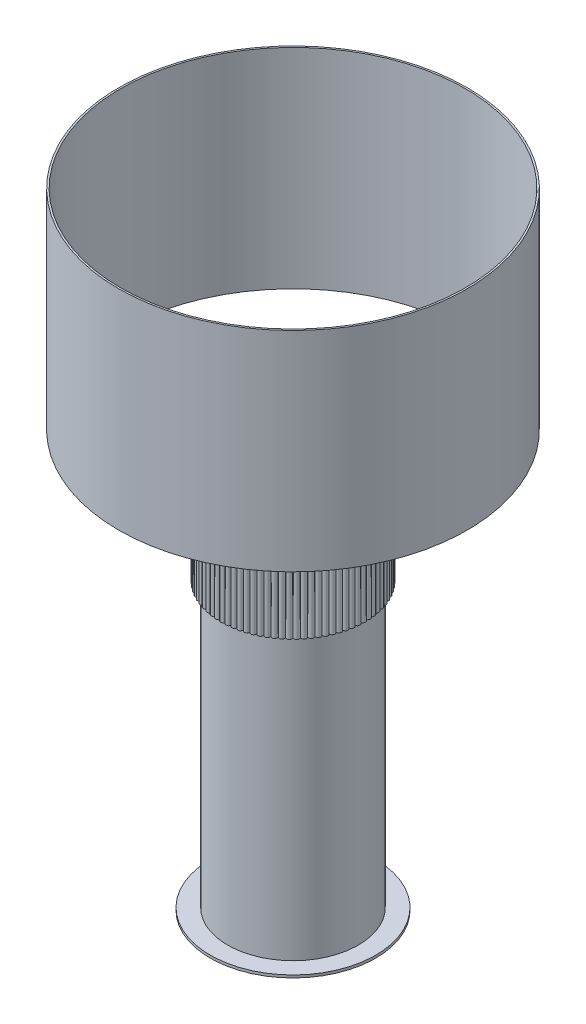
SolidWorks part; units mm, degrees
ref_plane "Alzado" through (0, 0, 0) normal (0, 0, 1) x (1, 0, 0)
ref_plane "Planta" through (0, 0, 0) normal (0, 1, 0) x (1, 0, 0)
ref_plane "Vista lateral" through (0, 0, 0) normal (1, 0, 0) x (0, 0, -1)
sketch "Croquis1" plane through (0, 0, 0) normal (0, 1, 0) x (1, 0, 0)
  arc A224 (2.9977, 80.1164) -> (-2.9977, 80.1164) centre (0, 80) ccw
  arc A225 (8.9765, 79.6683) -> (2.9977, 80.1164) centre (5.9784, 79.7763) ccw
  arc A226 (14.905, 78.7747) -> (8.9765, 79.6683) centre (11.9234, 79.1065) ccw
  arc A227 (20.7501, 77.4406) -> (14.905, 78.7747) centre (17.8017, 77.9942) ccw
  arc A228 (26.4793, 75.6734) -> (20.7501, 77.4406) centre (23.5804, 76.4458) ccw
  arc A229 (32.0603, 73.483) -> (26.4793, 75.6734) centre (29.2273, 74.4699) ccw
  arc A230 (37.4621, 70.8817) -> (32.0603, 73.483) centre (34.7107, 72.0775) ccw
  arc A231 (42.6543, 67.8839) -> (37.4621, 70.8817) centre (40, 69.282) ccw
  arc A232 (47.608, 64.5066) -> (42.6543, 67.8839) centre (45.0656, 66.0991) ccw
  arc A233 (52.2955, 60.7684) -> (47.608, 64.5066) centre (49.8792, 62.5465) ccw
  arc A234 (56.6905, 56.6905) -> (52.2955, 60.7684) centre (54.4138, 58.6441) ccw
  arc A235 (60.7684, 52.2955) -> (56.6905, 56.6905) centre (58.6441, 54.4138) ccw
  arc A236 (64.5066, 47.608) -> (60.7684, 52.2955) centre (62.5465, 49.8792) ccw
  arc A237 (67.8839, 42.6543) -> (64.5066, 47.608) centre (66.0991, 45.0656) ccw
  arc A238 (70.8817, 37.4621) -> (67.8839, 42.6543) centre (69.282, 40) ccw
  arc A239 (73.483, 32.0603) -> (70.8817, 37.4621) centre (72.0775, 34.7107) ccw
  arc A240 (75.6734, 26.4793) -> (73.483, 32.0603) centre (74.4699, 29.2273) ccw
  arc A241 (77.4406, 20.7501) -> (75.6734, 26.4793) centre (76.4458, 23.5804) ccw
  arc A242 (78.7747, 14.905) -> (77.4406, 20.7501) centre (77.9942, 17.8017) ccw
  arc A243 (79.6683, 8.9765) -> (78.7747, 14.905) centre (79.1065, 11.9234) ccw
  arc A244 (80.1164, 2.9977) -> (79.6683, 8.9765) centre (79.7763, 5.9784) ccw
  arc A245 (80.1164, -2.9977) -> (80.1164, 2.9977) centre (80, 0) ccw
  arc A246 (79.6683, -8.9765) -> (80.1164, -2.9977) centre (79.7763, -5.9784) ccw
  arc A247 (78.7747, -14.905) -> (79.6683, -8.9765) centre (79.1065, -11.9234) ccw
  arc A248 (77.4406, -20.7501) -> (78.7747, -14.905) centre (77.9942, -17.8017) ccw
  arc A249 (75.6734, -26.4793) -> (77.4406, -20.7501) centre (76.4458, -23.5804) ccw
  arc A250 (73.483, -32.0603) -> (75.6734, -26.4793) centre (74.4699, -29.2273) ccw
  arc A251 (70.8817, -37.4621) -> (73.483, -32.0603) centre (72.0775, -34.7107) ccw
  arc A252 (67.8839, -42.6543) -> (70.8817, -37.4621) centre (69.282, -40) ccw
  arc A253 (64.5066, -47.608) -> (67.8839, -42.6543) centre (66.0991, -45.0656) ccw
  arc A254 (60.7684, -52.2955) -> (64.5066, -47.608) centre (62.5465, -49.8792) ccw
  arc A255 (56.6905, -56.6905) -> (60.7684, -52.2955) centre (58.6441, -54.4138) ccw
  arc A256 (52.2955, -60.7684) -> (56.6905, -56.6905) centre (54.4138, -58.6441) ccw
  arc A257 (47.608, -64.5066) -> (52.2955, -60.7684) centre (49.8792, -62.5465) ccw
  arc A258 (42.6543, -67.8839) -> (47.608, -64.5066) centre (45.0656, -66.0991) ccw
  arc A259 (37.4621, -70.8817) -> (42.6543, -67.8839) centre (40, -69.282) ccw
  arc A260 (32.0603, -73.483) -> (37.4621, -70.8817) centre (34.7107, -72.0775) ccw
  arc A261 (26.4793, -75.6734) -> (32.0603, -73.483) centre (29.2273, -74.4699) ccw
  arc A262 (20.7501, -77.4406) -> (26.4793, -75.6734) centre (23.5804, -76.4458) ccw
  arc A263 (14.905, -78.7747) -> (20.7501, -77.4406) centre (17.8017, -77.9942) ccw
  arc A264 (8.9765, -79.6683) -> (14.905, -78.7747) centre (11.9234, -79.1065) ccw
  arc A265 (2.9977, -80.1164) -> (8.9765, -79.6683) centre (5.9784, -79.7763) ccw
  arc A266 (-2.9977, -80.1164) -> (2.9977, -80.1164) centre (0, -80) ccw
  arc A267 (-8.9765, -79.6683) -> (-2.9977, -80.1164) centre (-5.9784, -79.7763) ccw
  arc A268 (-14.905, -78.7747) -> (-8.9765, -79.6683) centre (-11.9234, -79.1065) ccw
  arc A269 (-20.7501, -77.4406) -> (-14.905, -78.7747) centre (-17.8017, -77.9942) ccw
  arc A270 (-26.4793, -75.6734) -> (-20.7501, -77.4406) centre (-23.5804, -76.4458) ccw
  arc A271 (-32.0603, -73.483) -> (-26.4793, -75.6734) centre (-29.2273, -74.4699) ccw
  arc A272 (-37.4621, -70.8817) -> (-32.0603, -73.483) centre (-34.7107, -72.0775) ccw
  arc A273 (-42.6543, -67.8839) -> (-37.4621, -70.8817) centre (-40, -69.282) ccw
  arc A274 (-47.608, -64.5066) -> (-42.6543, -67.8839) centre (-45.0656, -66.0991) ccw
  arc A275 (-52.2955, -60.7684) -> (-47.608, -64.5066) centre (-49.8792, -62.5465) ccw
  arc A276 (-56.6905, -56.6905) -> (-52.2955, -60.7684) centre (-54.4138, -58.6441) ccw
  arc A277 (-60.7684, -52.2955) -> (-56.6905, -56.6905) centre (-58.6441, -54.4138) ccw
  arc A278 (-64.5066, -47.608) -> (-60.7684, -52.2955) centre (-62.5465, -49.8792) ccw
  arc A279 (-67.8839, -42.6543) -> (-64.5066, -47.608) centre (-66.0991, -45.0656) ccw
  arc A280 (-70.8817, -37.4621) -> (-67.8839, -42.6543) centre (-69.282, -40) ccw
  arc A281 (-73.483, -32.0603) -> (-70.8817, -37.4621) centre (-72.0775, -34.7107) ccw
  arc A282 (-75.6734, -26.4793) -> (-73.483, -32.0603) centre (-74.4699, -29.2273) ccw
  arc A283 (-77.4406, -20.7501) -> (-75.6734, -26.4793) centre (-76.4458, -23.5804) ccw
  arc A284 (-78.7747, -14.905) -> (-77.4406, -20.7501) centre (-77.9942, -17.8017) ccw
  arc A285 (-79.6683, -8.9765) -> (-78.7747, -14.905) centre (-79.1065, -11.9234) ccw
  arc A286 (-80.1164, -2.9977) -> (-79.6683, -8.9765) centre (-79.7763, -5.9784) ccw
  arc A287 (-80.1164, 2.9977) -> (-80.1164, -2.9977) centre (-80, 0) ccw
  arc A288 (-79.6683, 8.9765) -> (-80.1164, 2.9977) centre (-79.7763, 5.9784) ccw
  arc A289 (-78.7747, 14.905) -> (-79.6683, 8.9765) centre (-79.1065, 11.9234) ccw
  arc A290 (-77.4406, 20.7501) -> (-78.7747, 14.905) centre (-77.9942, 17.8017) ccw
  arc A291 (-75.6734, 26.4793) -> (-77.4406, 20.7501) centre (-76.4458, 23.5804) ccw
  arc A292 (-73.483, 32.0603) -> (-75.6734, 26.4793) centre (-74.4699, 29.2273) ccw
  arc A293 (-70.8817, 37.4621) -> (-73.483, 32.0603) centre (-72.0775, 34.7107) ccw
  arc A294 (-67.8839, 42.6543) -> (-70.8817, 37.4621) centre (-69.282, 40) ccw
  arc A295 (-64.5066, 47.608) -> (-67.8839, 42.6543) centre (-66.0991, 45.0656) ccw
  arc A296 (-60.7684, 52.2955) -> (-64.5066, 47.608) centre (-62.5465, 49.8792) ccw
  arc A297 (-56.6905, 56.6905) -> (-60.7684, 52.2955) centre (-58.6441, 54.4138) ccw
  arc A298 (-52.2955, 60.7684) -> (-56.6905, 56.6905) centre (-54.4138, 58.6441) ccw
  arc A299 (-47.608, 64.5066) -> (-52.2955, 60.7684) centre (-49.8792, 62.5465) ccw
  arc A300 (-42.6543, 67.8839) -> (-47.608, 64.5066) centre (-45.0656, 66.0991) ccw
  arc A301 (-37.4621, 70.8817) -> (-42.6543, 67.8839) centre (-40, 69.282) ccw
  arc A302 (-32.0603, 73.483) -> (-37.4621, 70.8817) centre (-34.7107, 72.0775) ccw
  arc A303 (-26.4793, 75.6734) -> (-32.0603, 73.483) centre (-29.2273, 74.4699) ccw
  arc A304 (-20.7501, 77.4406) -> (-26.4793, 75.6734) centre (-23.5804, 76.4458) ccw
  arc A305 (-14.905, 78.7747) -> (-20.7501, 77.4406) centre (-17.8017, 77.9942) ccw
  arc A306 (-8.9765, 79.6683) -> (-14.905, 78.7747) centre (-11.9234, 79.1065) ccw
  arc A307 (-2.9977, 80.1164) -> (-8.9765, 79.6683) centre (-5.9784, 79.7763) ccw
  point P173 (0, 0)
  dimension "D2" = 6
  dimension "D3" = 84
extrude "Saliente-Extruir1" add sketch "Croquis1" along normal blind 100
sketch "Croquis2" plane through (0, 0, 0) normal (0, -1, 0) x (1, 0, 0)
  circle A0 centre (0, 0) radius 75
  dimension "D1" = 150
extrude "Cortar-Extruir1" cut sketch "Croquis2" against normal blind 75
sketch "Croquis3" plane through (0, 100, 0) normal (0, 1, 0) x (1, 0, 0)
  circle A0 centre (0, 0) radius 5
  dimension "D1" = 10
extrude "Cortar-Extruir2" cut sketch "Croquis3" against normal blind 75
sketch "Croquis4" plane through (0, 75, 0) normal (0, -1, 0) x (1, 0, 0)
  circle A0 centre (0, 0) radius 75
  circle A1 centre (0, 0) radius 70
  dimension "D1" = 150
  dimension "D2" = 140
extrude "Saliente-Extruir2" add sketch "Croquis4" along normal blind 400 separate body
sketch "Croquis5" plane through (0, 100, 0) normal (0, 1, 0) x (1, 0, 0)
  circle A0 centre (0, 0) radius 6
  dimension "D1" = 12
extrude "Saliente-Extruir3" add sketch "Croquis5" along normal blind 50 separate body
sketch "Croquis6" plane through (0, -325, 0) normal (0, -1, 0) x (1, 0, 0)
  circle A0 centre (0, 0) radius 95
  dimension "D1" = 190
extrude "Saliente-Extruir4" add sketch "Croquis6" along normal blind 3 separate body
sketch "Croquis7" plane through (0, -328, 0) normal (0, -1, 0) x (1, 0, 0)
  line L0 (0, 0) -> (0, 70) construction
  line L1 (0, 0) -> (60.6218, -35) construction
  line L2 (0, 0) -> (-60.6218, -35) construction
  circle A0 centre (60.6218, -35) radius 5
  circle A1 centre (0, 70) radius 5
  circle A2 centre (-60.6218, -35) radius 5
  dimension "D3" = 10
  dimension "D4" = 10
  dimension "D5" = 10
  dimension "D1" = 120
  dimension "D2" = 120
  dimension "D6" = 70
  dimension "D7" = 70
  dimension "D8" = 70
extrude "Saliente-Extruir5" add sketch "Croquis7" along normal blind 5 separate body
fillet "Redondeo1" radius 1 1 edges at (60.6218, -333, -40)
fillet "Redondeo2" radius 1 1 edges at (0, -333, 65)
fillet "Redondeo3" radius 1 1 edges at (-60.6218, -333, -40)
sketch "Croquis8" plane through (0, 150, 0) normal (0, 1, 0) x (1, 0, 0)
  circle A0 centre (0, 0) radius 200
  circle A1 centre (0, 0) radius 198
  dimension "D1" = 400
  dimension "D2" = 2
extrude "Saliente-Extruir6" add sketch "Croquis8" along normal blind 240 separate body
sketch "Croquis9" plane through (0, 100, 0) normal (0, 1, 0) x (1, 0, 0)
  circle A0 centre (0, 0) radius 20
  dimension "D1" = 40
extrude "Saliente-Extruir7" add sketch "Croquis9" along normal blind 2 separate body
